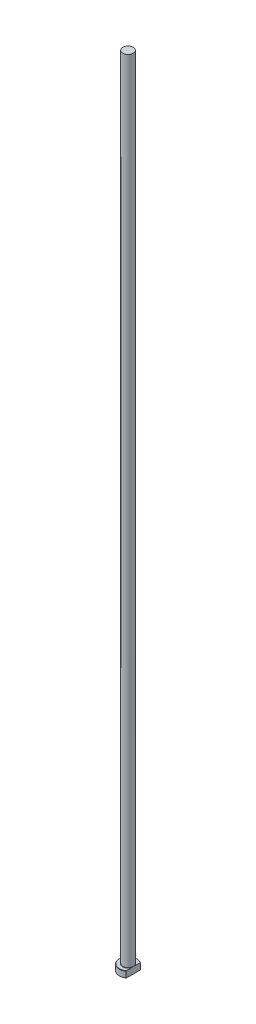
SolidWorks part; units mm, degrees
ref_plane "Front Plane" through (0, 0, 0) normal (0, 0, 1) x (1, 0, 0)
ref_plane "Top Plane" through (0, 0, 0) normal (0, 1, 0) x (1, 0, 0)
ref_plane "Right Plane" through (0, 0, 0) normal (1, 0, 0) x (0, 0, -1)
sketch "Sketch1" plane through (0, 0, 0) normal (0, 0, 1) x (1, 0, 0)
  line L0 (0, 259.9588) -> (0, -15.1925) construction
  line L1 (0, 0) -> (-7, 0)
  line L2 (-7, 0) -> (-7, 5)
  line L3 (-7, 5) -> (-4.1, 5)
  line L4 (-4.1, 5) -> (-4.1, 630)
  line L5 (-4.1, 630) -> (0, 630)
  line L6 (0, 630) -> (0, 0)
  dimension "L" = 630
  dimension "H" = 14
  dimension "T" = 5
  dimension "D" = 8.2
revolve "Revolve1" add sketch "Sketch1" angle 360 about L0
chamfer "Chamfer1" distance 0.2 angle 45 2 edges at (0, 5, 7) (0, 0, 7)
fillet "Fillet1" radius 0.2 1 edges at (0, 5, 4.1)
sketch "Sketch2" plane through (0, 0, 0) normal (0, 1, 0) x (1, 0, 0)
  line L0 (4.1, 5.6736) -> (4.1, -5.6736)
  circle A0 centre (0, 0) radius 7 construction
  arc A1 (4.1, -5.6736) -> (4.1, 5.6736) centre (0, 0) ccw
  circle A2 centre (0, 0) radius 4.1 construction
extrude "KEY" cut sketch "Sketch2" along normal through all
